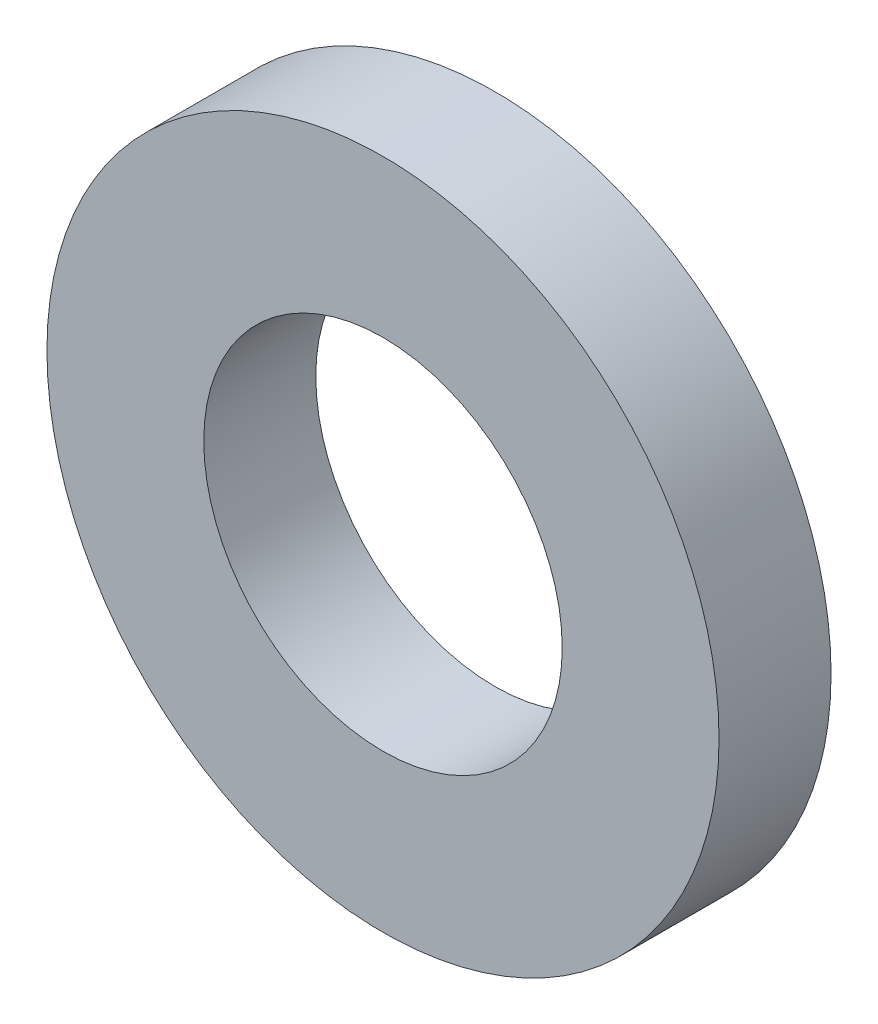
SolidWorks part; units mm, degrees
ref_plane "Alzado" through (0, 0, 0) normal (0, 0, 1) x (1, 0, 0)
ref_plane "Planta" through (0, 0, 0) normal (0, 1, 0) x (1, 0, 0)
ref_plane "Vista lateral" through (0, 0, 0) normal (1, 0, 0) x (0, 0, -1)
sketch "Croquis1" plane through (0, 0, 0) normal (0, 0, 1) x (1, 0, 0)
  circle A0 centre (0, 0) radius 4
  circle A1 centre (0, 0) radius 7.5
  dimension "D1" = 15
  dimension "D2" = 8
extrude "Saliente-Extruir1" add sketch "Croquis1" along normal mid plane 2.5
